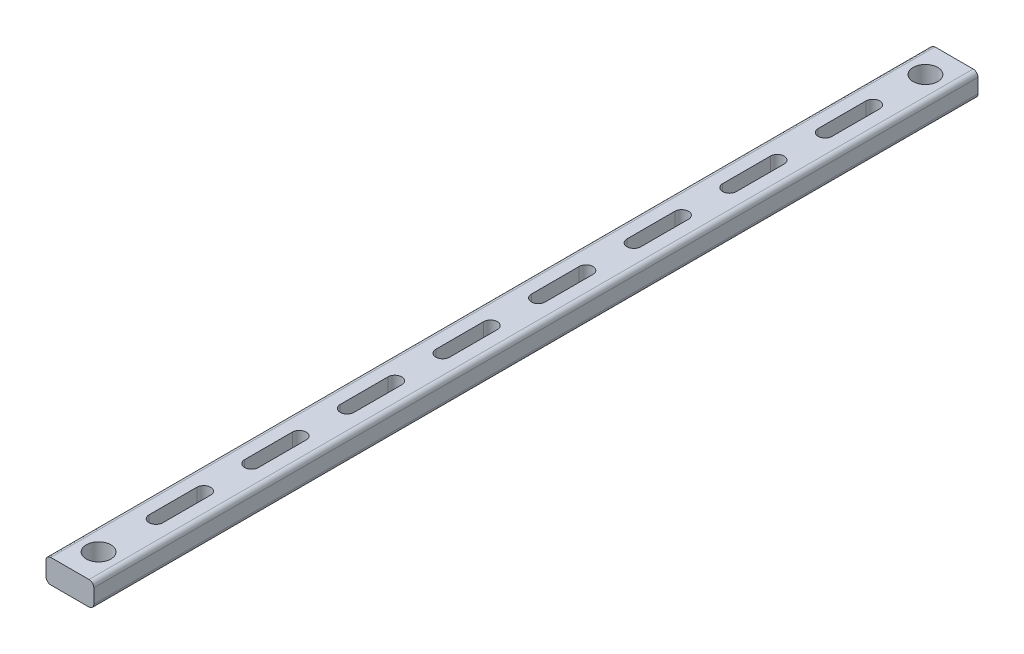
SolidWorks part; units mm, degrees
ref_plane "Front Plane" through (0, 0, 0) normal (0, 0, 1) x (1, 0, 0)
ref_plane "Top Plane" through (0, 0, 0) normal (0, 1, 0) x (1, 0, 0)
ref_plane "Right Plane" through (0, 0, 0) normal (1, 0, 0) x (0, 0, -1)
sketch "Sketch1" plane through (0, 0, 0) normal (0, 0, 1) x (1, 0, 0)
  line L0 (0, 1.5875) -> (0, -1.5875)
  line L1 (-3.175, 0) -> (3.175, 0) construction
  point P6 (0, 0)
  dimension "Width" = 6.35
  dimension "Thk" = 3.175
sketch "Sketch2" plane through (0, 0, 0) normal (1, 0, 0) x (0, 0, -1)
  line L0 (58.7375, 0) -> (-58.7375, 0)
  point P4 (0, 0)
  dimension "Length" = 117.475
sketch "Sketch3" plane through (0, 0, 0) normal (0, 0, 1) x (1, 0, 0)
  line L1 (2.54, 1.5875) -> (-2.54, 1.5875)
  line L2 (3.175, 0.9525) -> (3.175, -0.9525)
  line L3 (2.54, -1.5875) -> (-2.54, -1.5875)
  line L4 (-3.175, 0.9525) -> (-3.175, -0.9525)
  line L5 (3.175, 1.5875) -> (-3.175, -1.5875) construction
  line L6 (3.175, -1.5875) -> (-3.175, 1.5875) construction
  arc A0 (3.175, -0.9525) -> (2.54, -1.5875) centre (2.54, -0.9525) cw
  arc A1 (-2.54, -1.5875) -> (-3.175, -0.9525) centre (-2.54, -0.9525) cw
  arc A2 (2.54, 1.5875) -> (3.175, 0.9525) centre (2.54, 0.9525) cw
  arc A3 (-2.54, 1.5875) -> (-3.175, 0.9525) centre (-2.54, 0.9525) ccw
  point P0 (0, 0)
  point P21 (3.175, 1.5875)
  point P22 (3.175, -1.5875)
  point P23 (-3.175, -1.5875)
  point P24 (-3.175, 1.5875)
  dimension "D1" = 0.635
extrude "Boss-Extrude1" add sketch "Sketch3" along normal up to vertex (58.7375 mm away) and the other way up to vertex (58.7375 mm away)
sketch "Sketch4" plane through (0, 1.5875, 0) normal (0, 1, 0) x (1, 0, 0)
  line L0 (0, 54.9275) -> (0, -54.9275) construction
  circle A2 centre (0, -54.9275) radius 1.6383
  circle A3 centre (0, 54.9275) radius 1.6383
  point P5 (0, 0)
  dimension "D1" = 3.2766
  dimension "D2" = 109.855
extrude "Cut-Extrude1" cut sketch "Sketch4" against normal through all
sketch "Sketch5" plane through (0, 1.5875, 0) normal (0, 1, 0) x (1, 0, 0)
  line L0 (0, -47.3075) -> (0, -40.9575) construction
  line L1 (-0.9144, -47.3075) -> (-0.9144, -40.9575)
  line L2 (0.9144, -47.3075) -> (0.9144, -40.9575)
  line L3 (2.54, -58.7375) -> (-2.54, -58.7375) construction
  arc A0 (-0.9144, -47.3075) -> (0.9144, -47.3075) centre (0, -47.3075) ccw
  arc A1 (0.9144, -40.9575) -> (-0.9144, -40.9575) centre (0, -40.9575) ccw
  point P3 (0, -44.1325)
  dimension "D1" = 11.43
  dimension "D2" = 6.35
  dimension "D3" = 1.8288
extrude "Cut-Extrude2" cut sketch "Sketch5" against normal through all
pattern_linear "LPattern1" count 8 spacing 12.7 along (0, 0, -1) of "Cut-Extrude2"
